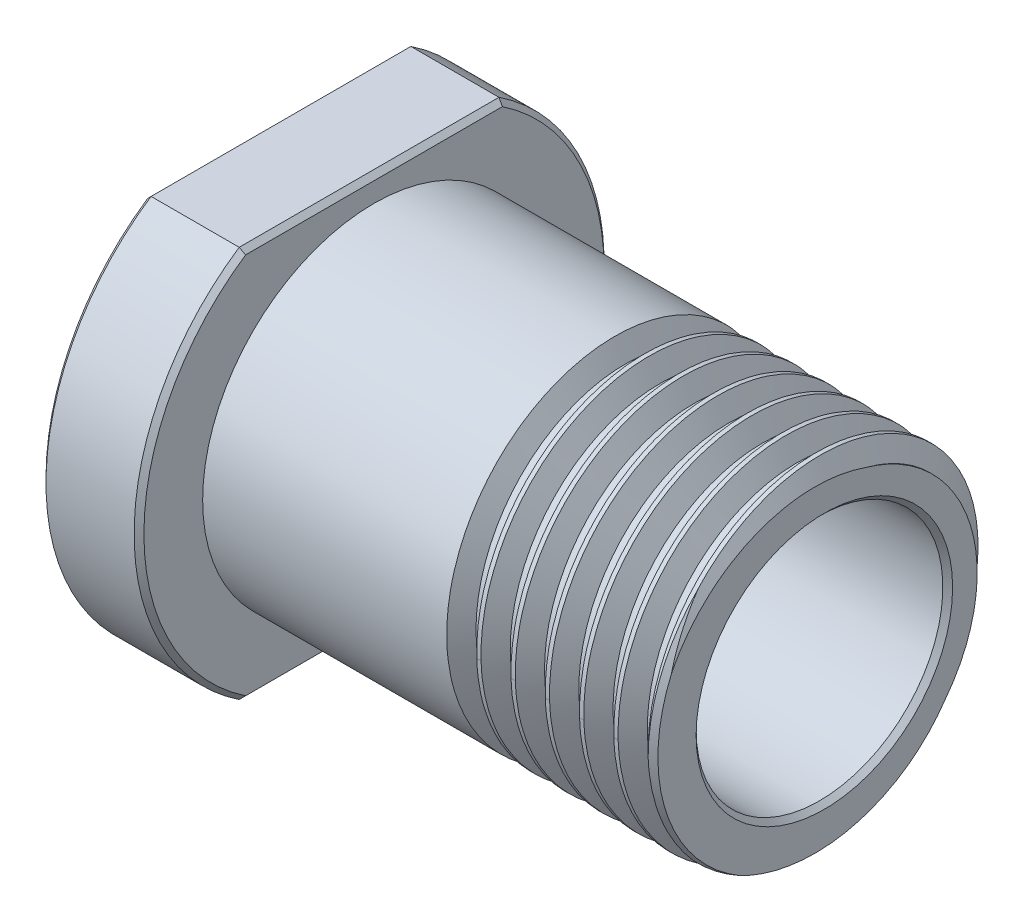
SolidWorks part; units mm, degrees
ref_plane "Front Plane" through (0, 0, 0) normal (0, 0, 1) x (1, 0, 0)
ref_plane "Top Plane" through (0, 0, 0) normal (0, 1, 0) x (1, 0, 0)
ref_plane "Right Plane" through (0, 0, 0) normal (1, 0, 0) x (0, 0, -1)
sketch "Sketch1" plane through (0, 0, 0) normal (0, 0, 1) x (1, 0, 0)
  line L0 (0, 24) -> (0, 12.6)
  line L1 (0, 12.6) -> (56, 12.6)
  line L2 (56, 12.6) -> (56, 17.5)
  line L3 (56, 17.5) -> (10, 17.5)
  line L4 (10, 17.5) -> (10, 24)
  line L5 (10, 24) -> (0, 24)
  line L6 (0, 0) -> (55.5357, 0) construction
  line L7 (10, 17.5) -> (33, 17.5)
  line L8 (33, 17.5) -> (34.5, 16) construction
  line L9 (34.5, 16) -> (56, 16) construction
  line L10 (56, 16) -> (56, 12.6) construction
  dimension "D1" = 25.2
  dimension "D2" = 56
  dimension "D3" = 17.5
  dimension "D4" = 10
  dimension "D5" = 24
  dimension "D6" = 16
  dimension "D7" = 45
revolve "Revolve1" add sketch "Sketch1" angle 360 about L6
thread "Thread2" pitch 3.5 start angle 0, offset 3, length 20, pitch 3.5, diameter 35
ref_plane "Plane2" through (59, 0, 17.5) normal (0, -1, 0) x (0, 0, 1)
sketch "Thread Profile2" plane through (59, 0, 17.5) normal (0, -1, 0) x (0, 0, 1)
  line L0 (0, 0) -> (0, 3.5) construction
  line L11 (0, 0) -> (0, 3.0625)
  line L12 (0, 3.0625) -> (-1.8944, 1.9687)
  line L13 (-1.8944, 1.9687) -> (-1.8944, 1.0937)
  line L15 (-1.8944, 1.0937) -> (0, 0)
  line L17 (-1.8944, 1.5312) -> (0, 1.5312) construction
  point P2 (0, 0)
  dimension "Pitch" = 3.5
  dimension "Profile_Angle" = 60
  dimension "Profile_Land" = 0.875
  dimension "Profile_Height" = 1.8944
sketch "Sketch10" plane through (0, 0, 0) normal (-1, 0, 0) x (0, 0, 1)
  line L1 (-13.2665, 20) -> (13.2665, 20)
  line L2 (-13.2665, 20) -> (-13.2665, 25.6417)
  line L3 (-13.2665, 25.6417) -> (13.2665, 25.6417)
  line L4 (13.2665, 20) -> (13.2665, 25.6417)
  line L5 (-13.2665, 20) -> (13.2665, 25.6417) construction
  line L6 (-13.2665, 25.6417) -> (13.2665, 20) construction
  line L7 (-13.2665, -20) -> (13.2665, -20)
  line L8 (-13.2665, -20) -> (-13.2665, -25.6417)
  line L9 (-13.2665, -25.6417) -> (13.2665, -25.6417)
  line L10 (13.2665, -20) -> (13.2665, -25.6417)
  line L11 (-13.2665, -20) -> (13.2665, -25.6417) construction
  line L12 (-13.2665, -25.6417) -> (13.2665, -20) construction
  circle A0 centre (0, 0) radius 24 construction
  point P4 (0, 22.8209)
  point P11 (0, -22.8209)
  point P12 (0, 0)
  point P14 (0, 0)
  point P15 (0, 0)
  dimension "D1" = 40
extrude "Cut-Extrude1" cut sketch "Sketch10" against normal through all
chamfer "Chamfer2" distance 0.5 angle 45 12 edges at (0, -20, 0) (0, 0, 24) (0, 0, -24) (0, 20, 0) (0, 0, 12.6) (56, -16.0056, -4.3758) (56, -7.5847, 15.7709) (56, 0, 12.6) (10, -20, 0) (10, 0, -24) (10, 0, 24) (10, 20, 0)
